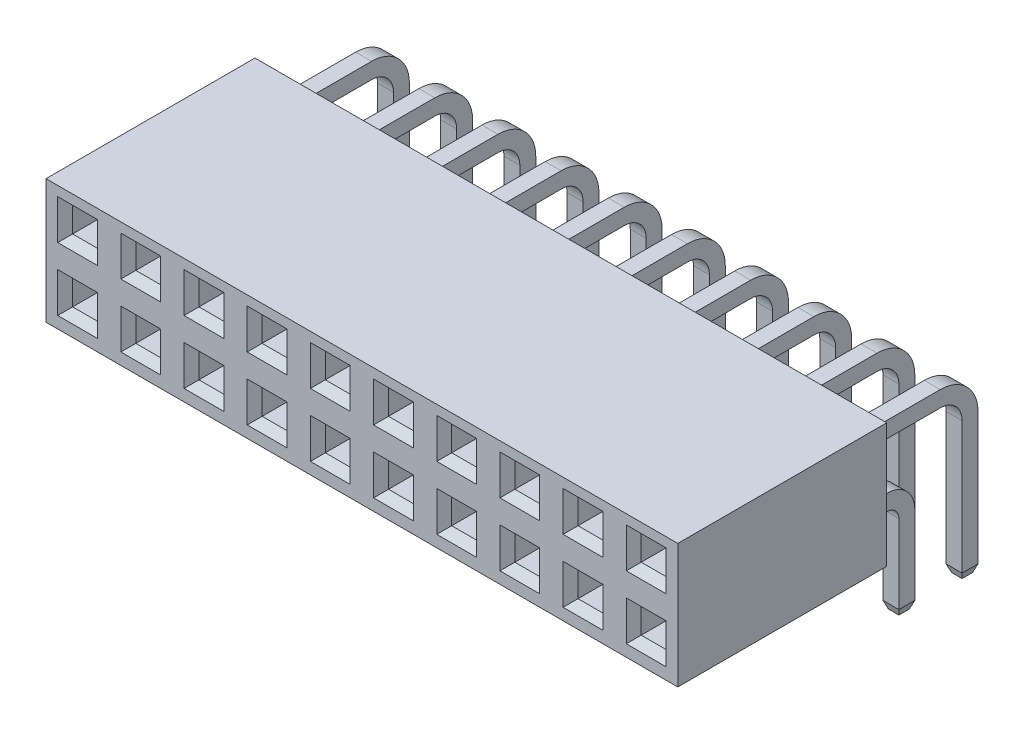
SolidWorks part; units mm, degrees
ref_plane "Front" through (0, 0, 0) normal (0, 0, 1) x (1, 0, 0)
ref_plane "Top" through (0, 0, 0) normal (0, 1, 0) x (1, 0, 0)
ref_plane "Right" through (0, 0, 0) normal (1, 0, 0) x (0, 0, -1)
sketch "Эскиз1" plane through (0, 0, 0) normal (1, 0, 0) x (0, 0, -1)
  line L0 (0, -3) -> (0, 0.47) construction
  line L1 (-0.8, 1.27) -> (-4.16, 1.27) construction
  line L2 (2.54, -3) -> (2.54, 2.61) construction
  line L3 (1.34, 3.81) -> (-4.16, 3.81) construction
  line L4 (0.32, -3) -> (0.32, 0.47)
  line L5 (-0.8, 1.59) -> (-4.16, 1.59)
  line L6 (2.86, -3) -> (2.86, 2.61)
  line L7 (1.34, 4.13) -> (-4.16, 4.13)
  line L8 (-0.32, -3) -> (-0.32, 0.47)
  line L9 (-0.8, 0.95) -> (-4.16, 0.95)
  line L10 (2.22, -3) -> (2.22, 2.61)
  line L11 (1.34, 3.49) -> (-4.16, 3.49)
  line L12 (-0.32, -3) -> (0.32, -3)
  line L13 (2.22, -3) -> (2.86, -3)
  line L14 (-4.16, 3.49) -> (-4.16, 4.13)
  line L15 (-4.16, 1.59) -> (-4.16, 0.95)
  arc A0 (0, 0.47) -> (-0.8, 1.27) centre (-0.8, 0.47) ccw construction
  arc A1 (2.54, 2.61) -> (1.34, 3.81) centre (1.34, 2.61) ccw construction
  arc A2 (0.32, 0.47) -> (-0.8, 1.59) centre (-0.8, 0.47) ccw
  arc A3 (2.86, 2.61) -> (1.34, 4.13) centre (1.34, 2.61) ccw
  arc A4 (-0.32, 0.47) -> (-0.8, 0.95) centre (-0.8, 0.47) ccw
  arc A5 (2.22, 2.61) -> (1.34, 3.49) centre (1.34, 2.61) ccw
  dimension "D3" = 0.8
  dimension "D4" = 1.2
  dimension "D1" = 2.54
  dimension "D2" = 3
  dimension "D5" = 2.54
  dimension "D6" = 1.27
  dimension "D7" = 4.16
  dimension "D8" = 0.32
  dimension "D9" = 0.32
extrude "Вытянуть1" add sketch "Эскиз1" along normal mid plane 0.64
sketch "Эскиз2" plane through (0, 0, 0) normal (0, 1, 0) x (1, 0, 0)
  line L0 (0, 0) -> (0, -1.76) construction
  line L1 (-1.27, -1.76) -> (1.27, -1.76)
  line L2 (-1.27, -1.76) -> (-1.27, -10.16)
  line L3 (-1.27, -10.16) -> (1.27, -10.16)
  line L4 (1.27, -1.76) -> (1.27, -10.16)
  dimension "D1" = 2.54
  dimension "D2" = 8.4
  dimension "D3" = 10.16
extrude "Вытянуть2" add sketch "Эскиз2" along normal blind 5
sketch "Эскиз3" plane through (0, 0, 10.16) normal (0, 0, 1) x (1, 0, 0)
  line L0 (-0.5, 3.81) -> (0.5, 3.81) construction
  line L1 (-0.5, 1.77) -> (0.5, 1.77)
  line L2 (-0.5, 1.77) -> (-0.5, 0.77)
  line L3 (-0.5, 0.77) -> (0.5, 0.77)
  line L4 (0.5, 1.77) -> (0.5, 0.77)
  line L5 (-0.5, 4.31) -> (0.5, 4.31)
  line L6 (-0.5, 4.31) -> (-0.5, 3.31)
  line L7 (-0.5, 3.31) -> (0.5, 3.31)
  line L8 (0.5, 4.31) -> (0.5, 3.31)
  line L9 (-0.5, 1.27) -> (0.5, 1.27) construction
  dimension "D1" = 1
extrude "Вырез-Вытянуть1" cut sketch "Эскиз3" against normal blind 6
chamfer "Фаска1" distance 0.3 angle 45 8 edges at (0, 0.77, 10.16) (0.5, 1.27, 10.16) (0, 1.77, 10.16) (-0.5, 1.27, 10.16) (0.5, 3.81, 10.16) (0, 4.31, 10.16) (-0.5, 3.81, 10.16) (0, 3.31, 10.16)
chamfer "Фаска2" distance 0.3 angle 20 8 edges at (0, -3, -2.22) (0.32, -3, -2.54) (0, -3, -2.86) (-0.32, -3, -2.54) (0, -3, 0.32) (0.32, -3, 0) (0, -3, -0.32) (-0.32, -3, 0)
pattern_linear "Линейный массив1" count 10 spacing 2.54 along (-1, 0, 0) of "Вытянуть2", "Вырез-Вытянуть1", "Фаска1"
pattern_linear "Линейный массив2" count 10 spacing 2.54 along (-1, 0, 0) of "Вытянуть1", "Фаска2"
equation "\"D1@Линейный массив2\" = \"N@Линейный массив1\""
